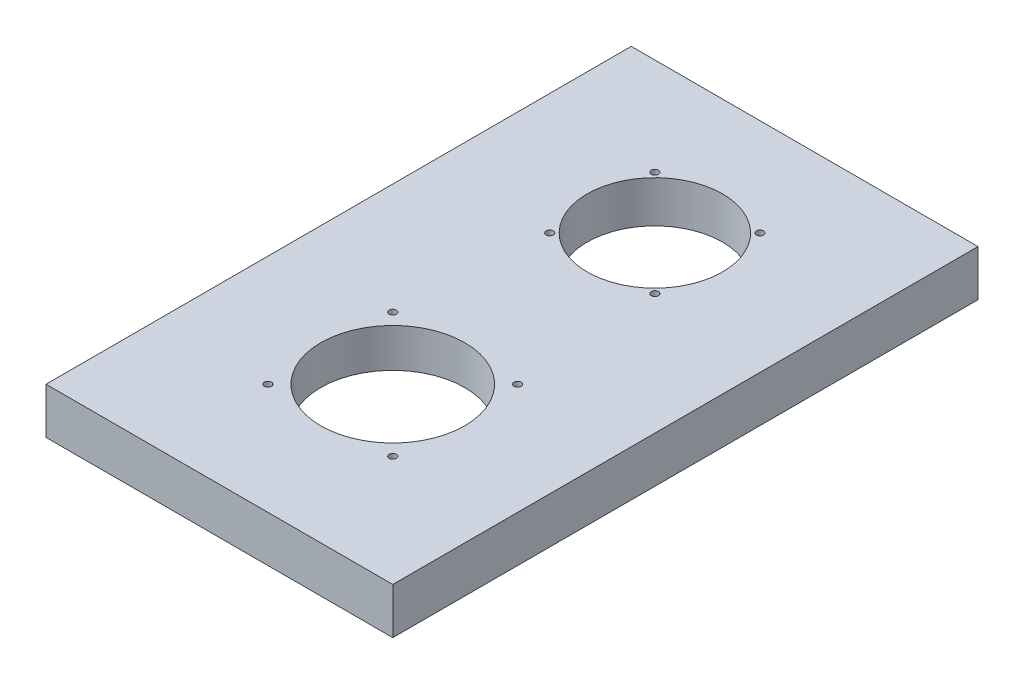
SolidWorks part; units mm, degrees
ref_plane "Front Plane" through (0, 0, 0) normal (0, 0, 1) x (1, 0, 0)
ref_plane "Top Plane" through (0, 0, 0) normal (0, 1, 0) x (1, 0, 0)
ref_plane "Right Plane" through (0, 0, 0) normal (1, 0, 0) x (0, 0, -1)
sketch "Sketch1" plane through (0, 0, 0) normal (0, 1, 0) x (1, 0, 0)
  line L1 (-60.2, 101.6) -> (60.2, 101.6)
  line L2 (-60.2, 101.6) -> (-60.2, -101.6)
  line L3 (-60.2, -101.6) -> (60.2, -101.6)
  line L4 (60.2, 101.6) -> (60.2, -101.6)
  line L5 (-60.2, 101.6) -> (60.2, -101.6) construction
  line L6 (-60.2, -101.6) -> (60.2, 101.6) construction
  point P0 (0, 0)
  dimension "D1" = 120.4
  dimension "D2" = 203.2
extrude "Boss-Extrude1" add sketch "Sketch1" along normal blind 16
sketch "Sketch2" plane through (0, 0, 0) normal (0, -1, 0) x (1, 0, 0)
  line L0 (60.2, -101.6) -> (-60.2, -101.6) construction
  circle A0 centre (0, -49.6) radius 23.5
  dimension "D1" = 47
  dimension "D2" = 52
extrude "Cut-Extrude1" cut sketch "Sketch2" against normal through all
sketch "Sketch3" plane through (0, 0, 0) normal (0, -1, 0) x (1, 0, 0)
  circle A0 centre (0, -49.6) radius 33
  dimension "D1" = 66
extrude "Cut-Extrude2" cut sketch "Sketch3" against normal blind 1.5
sketch "Sketch4" plane through (0, 1.5, 0) normal (0, -1, 0) x (1, 0, 0)
  line L0 (0, -49.6) -> (-18.2434, -31.3566) construction
  line L1 (0, -49.6) -> (0, -23.8) construction
  line L2 (0, -49.6) -> (-18.2434, -67.8434) construction
  circle A0 centre (0, -49.6) radius 25.8 construction
  circle A1 centre (-18.2434, -31.3566) radius 1.25
  circle A2 centre (-18.2434, -67.8434) radius 1.25
  circle A3 centre (18.2434, -67.8434) radius 1.25
  circle A4 centre (18.2434, -31.3566) radius 1.25
  dimension "D1" = 51.6
  dimension "D4" = 2.5
  dimension "D2" = 45
  dimension "D3" = 90
extrude "Cut-Extrude3" cut sketch "Sketch4" against normal through all
sketch "Sketch5" plane through (0, 0, 0) normal (0, -1, 0) x (1, 0, 0)
  line L0 (-60.2, 101.6) -> (60.2, 101.6) construction
  line L1 (0, 41.4) -> (0, 86.771) construction
  line L2 (0, 41.4) -> (-21.6728, 63.0728) construction
  line L3 (0, 41.4) -> (-21.6728, 19.7272) construction
  circle A0 centre (0, 41.4) radius 25
  circle A1 centre (0, 41.4) radius 30.65 construction
  circle A2 centre (-21.6728, 63.0728) radius 1.25
  circle A3 centre (-21.6728, 19.7272) radius 1.25
  circle A4 centre (21.6728, 19.7272) radius 1.25
  circle A5 centre (21.6728, 63.0728) radius 1.25
  dimension "D1" = 50
  dimension "D3" = 61.3
  dimension "D6" = 2.5
  dimension "D2" = 60.2
  dimension "D4" = 45
  dimension "D5" = 90
extrude "Cut-Extrude4" cut sketch "Sketch5" against normal through all
sketch "Sketch6" plane through (0, 0, 0) normal (0, -1, 0) x (1, 0, 0)
  circle A0 centre (0, 41.4) radius 38
  dimension "D1" = 76
extrude "Cut-Extrude5" cut sketch "Sketch6" against normal blind 2.5
